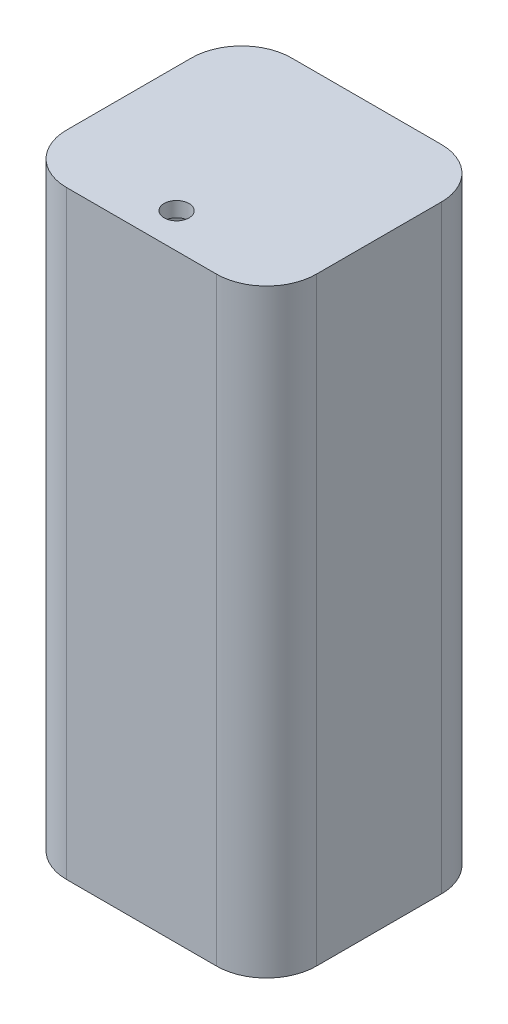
SolidWorks part; units mm, degrees
ref_plane "Front Plane" through (0, 0, 0) normal (0, 0, 1) x (1, 0, 0)
ref_plane "Top Plane" through (0, 0, 0) normal (0, 1, 0) x (1, 0, 0)
ref_plane "Right Plane" through (0, 0, 0) normal (1, 0, 0) x (0, 0, -1)
sketch "Sketch2" plane through (0, 0, 0) normal (0, 1, 0) x (1, 0, 0)
  line L1 (-25, -22.5) -> (25, -22.5)
  line L2 (-25, -22.5) -> (-25, 22.5)
  line L3 (-25, 22.5) -> (25, 22.5)
  line L4 (25, -22.5) -> (25, 22.5)
  line L5 (-25, -22.5) -> (25, 22.5) construction
  line L6 (-25, 22.5) -> (25, -22.5) construction
  point P0 (0, 0)
  dimension "D1" = 50
  dimension "D2" = 45
extrude "Boss-Extrude1" add sketch "Sketch2" along normal blind 120
fillet "Fillet1" radius 10 4 edges at (-25, 60, -22.5) (25, 60, -22.5) (25, 60, 22.5) (-25, 60, 22.5)
shell "Shell1" thickness 3
sketch "Sketch4" plane through (0, 120, 0) normal (0, 1, 0) x (1, 0, 0)
  line L4 (15, 22.5) -> (-15, 22.5)
  line L5 (-25, 12.5) -> (-25, -12.5)
  line L6 (-15, -22.5) -> (15, -22.5)
  line L7 (25, -12.5) -> (25, 12.5)
  line L8 (15, 22.5) -> (-15, 22.5)
  line L9 (-25, 12.5) -> (-25, -12.5)
  line L10 (-15, -22.5) -> (15, -22.5)
  line L11 (25, -12.5) -> (25, 12.5)
  arc A4 (-15, 22.5) -> (-25, 12.5) centre (-15, 12.5) ccw
  arc A5 (-25, -12.5) -> (-15, -22.5) centre (-15, -12.5) ccw
  arc A6 (15, -22.5) -> (25, -12.5) centre (15, -12.5) ccw
  arc A7 (25, 12.5) -> (15, 22.5) centre (15, 12.5) ccw
  arc A8 (-15, 22.5) -> (-25, 12.5) centre (-15, 12.5) ccw
  arc A9 (-25, -12.5) -> (-15, -22.5) centre (-15, -12.5) ccw
  arc A10 (15, -22.5) -> (25, -12.5) centre (15, -12.5) ccw
  arc A11 (25, 12.5) -> (15, 22.5) centre (15, 12.5) ccw
  dimension "D1" = 0
extrude "Boss-Extrude2" add sketch "Sketch4" against normal blind 3
sketch "Sketch3" plane through (0, 0, 0) normal (0, -1, 0) x (1, 0, 0)
  line L0 (-15, 22.5) -> (15, 22.5) construction
  circle A0 centre (0, 15.5) radius 2.5
  dimension "D1" = 5
  dimension "D2" = 7
extrude "Cut-Extrude2" cut sketch "Sketch3" against normal through all contours A0
